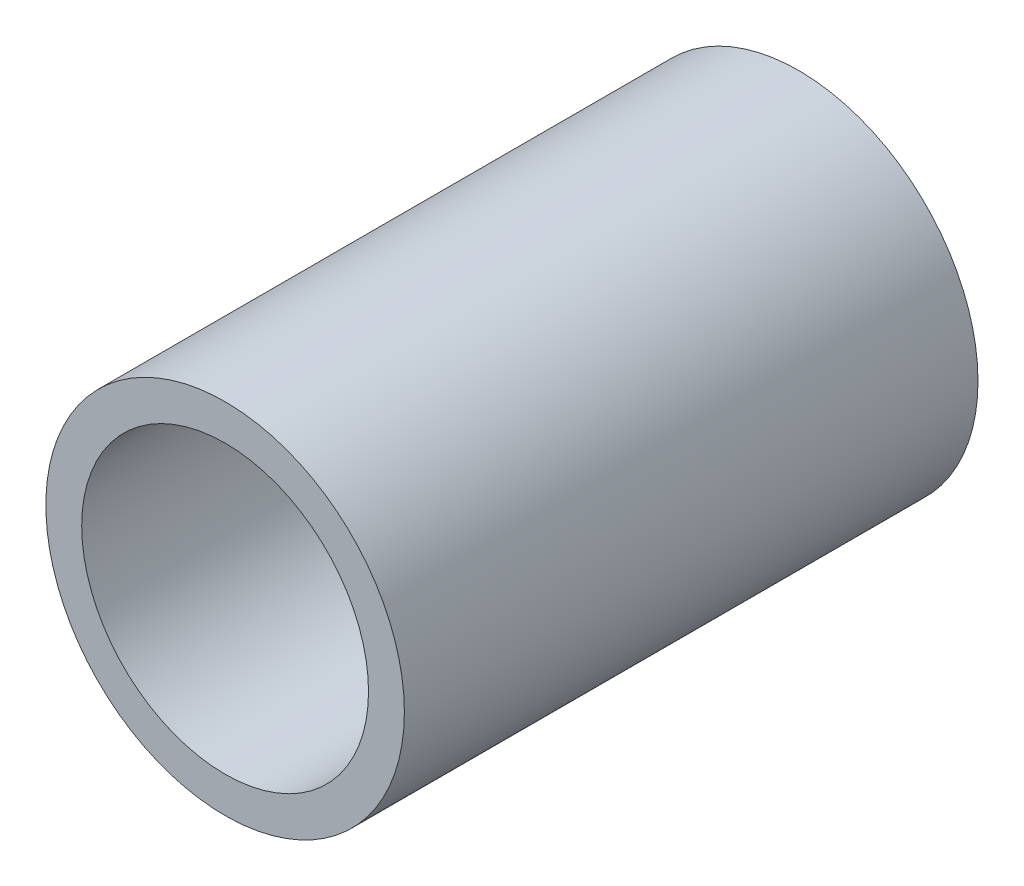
SolidWorks part; units mm, degrees
ref_plane "Plan de face" through (0, 0, 0) normal (0, 0, 1) x (1, 0, 0)
ref_plane "Plan de dessus" through (0, 0, 0) normal (0, 1, 0) x (1, 0, 0)
ref_plane "Plan de droite" through (0, 0, 0) normal (1, 0, 0) x (0, 0, -1)
sketch "Esquisse1" plane through (0, 0, 0) normal (0, 0, 1) x (1, 0, 0)
  circle A0 centre (0, 0) radius 62.5
  circle A1 centre (0, 0) radius 50
  dimension "D1" = 125
  dimension "D2" = 100
extrude "Extrusion1" add sketch "Esquisse1" along normal blind 200
